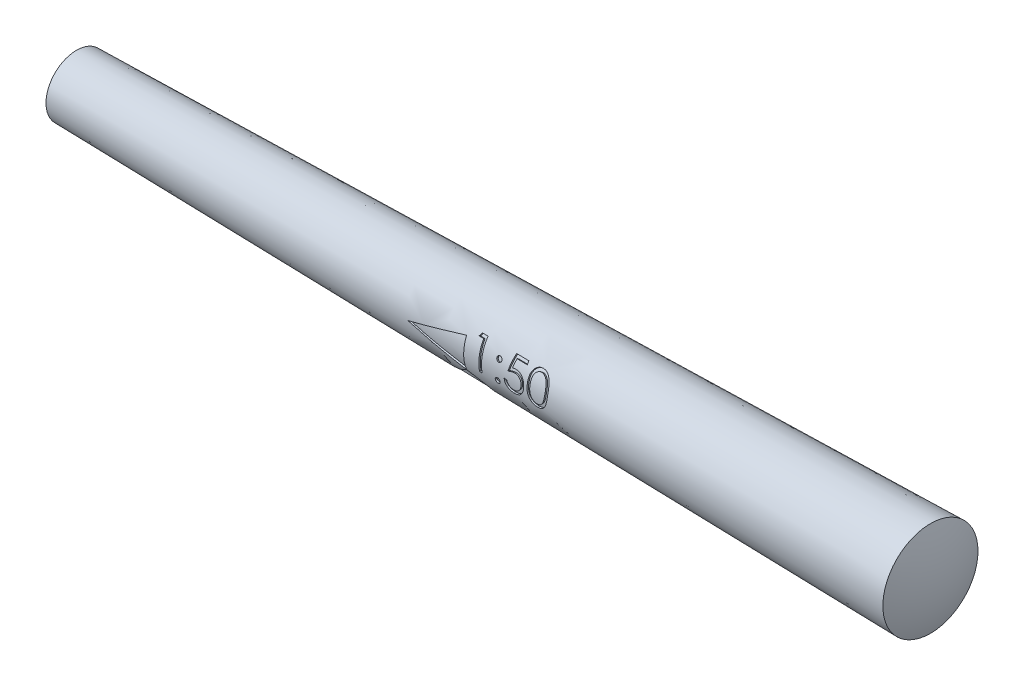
SolidWorks part; units mm, degrees
ref_plane "Front Plane" through (0, 0, 0) normal (0, 0, 1) x (1, 0, 0)
ref_plane "Top Plane" through (0, 0, 0) normal (0, 1, 0) x (1, 0, 0)
ref_plane "Right Plane" through (0, 0, 0) normal (1, 0, 0) x (0, 0, -1)
sketch "Sketch1" plane through (0, 0, 0) normal (1, 0, 0) x (0, 0, -1)
  circle A0 centre (0, 0) radius 1
  dimension "D1" = 2
extrude "Extrude1" add sketch "Sketch1" along normal mid plane 28
draft "Draft1" type of draft neutral plane draft angle 1.146 faces to draft 1 parameters "D1"=1.146
sketch "Sketch2" plane through (0, 0, 0) normal (0, 0, 1) x (1, 0, 0)
  line L0 (-14, 0) -> (-14, 1)
  line L1 (-14, 1) -> (-14, -1) construction
  line L2 (-14, 0) -> (-14.3, 0)
  line L3 (-14.3, 0) -> (-14.3, -1.28) construction
  line L4 (14, 0) -> (14, 1.56)
  line L5 (14, -1.56) -> (14, 1.56) construction
  line L6 (14, 0) -> (14.3, 0)
  line L7 (14.3, 0) -> (14.3, -1.28) construction
  line L8 (-14, -1) -> (14, -1.56) construction
  arc A0 (-14.3, 0) -> (-14, 1) centre (-12.4833, 0) cw
  arc A1 (14.3, 0) -> (14, 1.56) centre (10.0939, 0) ccw
  point P14 (0, -1.28)
revolve "Revolve1" add sketch "Sketch2" angle 360 about L2
sketch "Sketch5" plane through (0, 0, 0) normal (0, 0, 1) x (1, 0, 0)
  line L0 (0, 1.28) -> (0, -1.28) construction
  line L1 (14, 1.56) -> (-14, 1) construction
  line L2 (-14, -1) -> (14, -1.56) construction
ref_plane "Plane2" through (0, 0, 0) normal (-0.02, 0, 0.9998) x (0.9998, 0, 0.02)
sketch "Sketch6" plane through (0, 0, 0) normal (-0.02, 0, 0.9998) x (0.9998, 0, 0.02)
  line L0 (0, 0) -> (0, 0.5)
  line L1 (0, 1.28) -> (0, -1.28) construction
  line L2 (0, 0.5) -> (-1.866, 0)
  line L3 (-1.866, 0) -> (0, -0.5)
  line L4 (0, -0.5) -> (0, 0)
  line L5 (0, -0.25) -> (3, -0.25) construction
  text T0 "1:50" font "Century Gothic" height 1
  dimension "D1" = 1
  dimension "D2" = 30
  dimension "D3" = 3
wrap "Wrap2" sketch "Sketch6" wrap type deboss source sketch "Sketch6" thickness 0.05 parameters "D1"=0.05
equation "\"D2@Sketch2\" = \"D1@Sketch2\""
